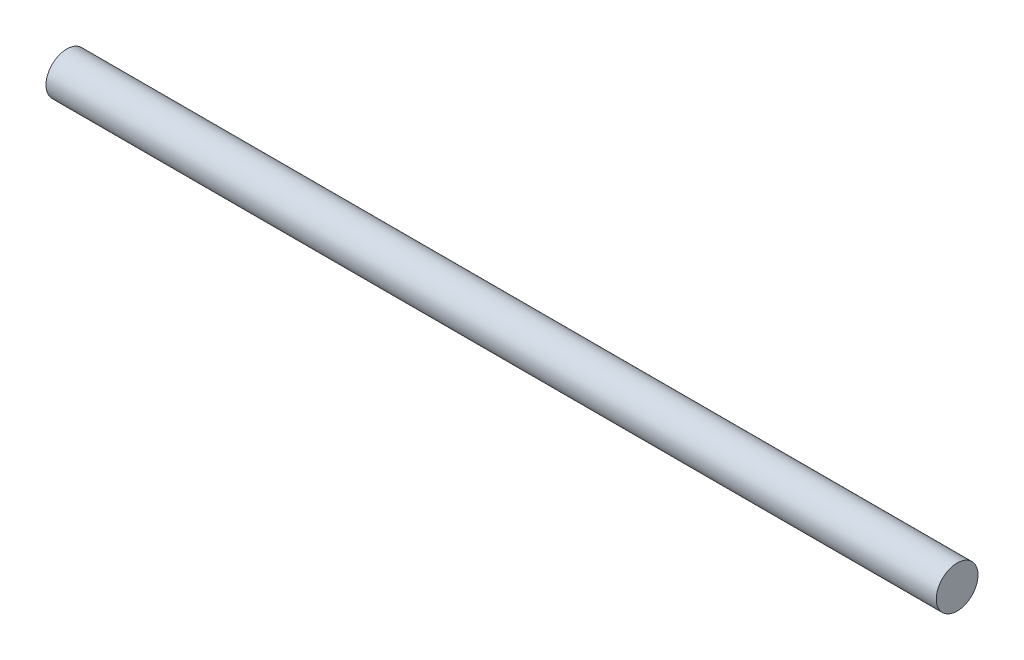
SolidWorks part; units mm, degrees
ref_plane "Front Plane" through (0, 0, 0) normal (0, 0, 1) x (1, 0, 0)
ref_plane "Top Plane" through (0, 0, 0) normal (0, 1, 0) x (1, 0, 0)
ref_plane "Right Plane" through (0, 0, 0) normal (1, 0, 0) x (0, 0, -1)
sketch "Sketch1" plane through (0, 0, 0) normal (1, 0, 0) x (0, 0, -1)
  circle A0 centre (0, 0) radius 4.7625
  dimension "D1" = 9.525
extrude "Extrude1" add sketch "Sketch1" along normal blind 203.2
